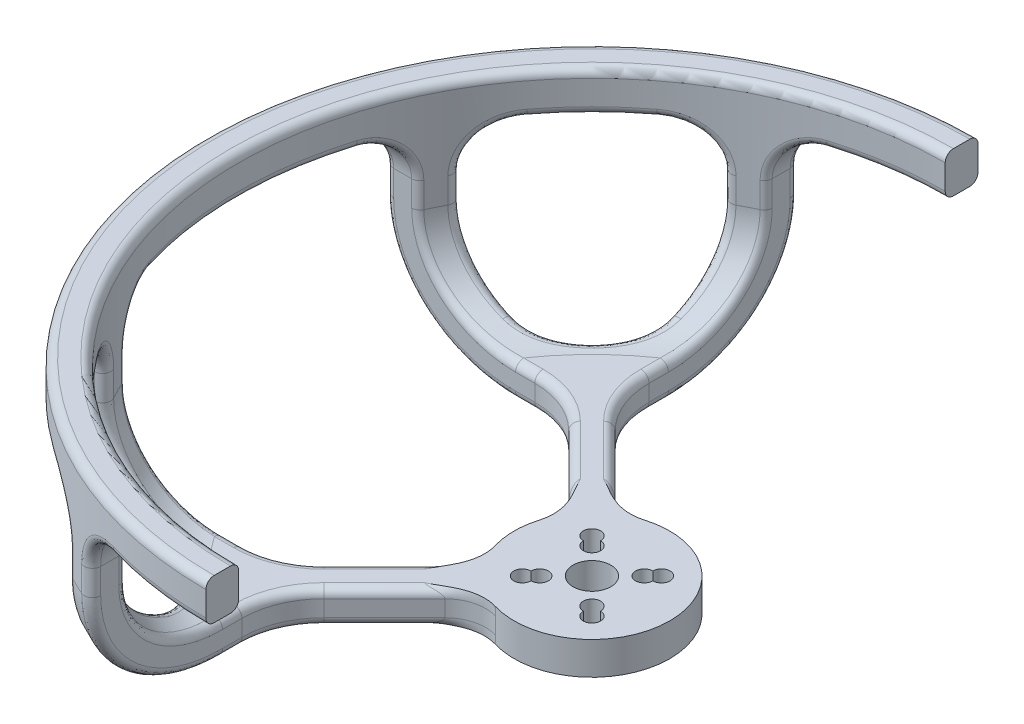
SolidWorks part; units mm, degrees
ref_plane "Front Plane" through (0, 0, 0) normal (0, 0, 1) x (1, 0, 0)
ref_plane "Top Plane" through (0, 0, 0) normal (0, 1, 0) x (1, 0, 0)
ref_plane "Right Plane" through (0, 0, 0) normal (1, 0, 0) x (0, 0, -1)
sketch "Sketch1" plane through (0, 0, 0) normal (0, 1, 0) x (1, 0, 0)
  line L0 (-4.2426, 4.2426) -> (0, 0) construction
  line L1 (0, 0) -> (0, 9.5) construction
  circle A0 centre (0, 0) radius 9.5
  circle A1 centre (-4.2426, 4.2426) radius 1.05
  circle A2 centre (-3.182, 3.182) radius 1.05
  circle A3 centre (3.182, 3.182) radius 1.05
  circle A4 centre (4.2426, 4.2426) radius 1.05
  circle A5 centre (3.182, -3.182) radius 1.05
  circle A6 centre (4.2426, -4.2426) radius 1.05
  circle A7 centre (-3.182, -3.182) radius 1.05
  circle A8 centre (-4.2426, -4.2426) radius 1.05
  circle A9 centre (0, 0) radius 2.3
  point P23 (0, 0)
  dimension "D2" = 2.1
  dimension "D3" = 4.5
  dimension "D4" = 6
  dimension "D5" = 19
  dimension "D7" = 4.6
  dimension "D1" = 45
  dimension "D6" = 4
extrude "Boss-Extrude1" add sketch "Sketch1" along normal blind 4 contours A0 A8 A7 A6 A5 A4 A3 A2 A1
ref_plane "Plane1" through (0, 27.1, 0) normal (0, 1, 0) x (1, 0, 0)
sketch "change diameter here" plane through (0, 27.1, 0) normal (0, 1, 0) x (1, 0, 0)
  line L0 (0, 47.1) -> (0, -47.1) construction
  line L1 (0, 0) -> (0, 9.5) construction
  line L2 (0, 47.1) -> (0, 43.1)
  line L3 (0, -43.1) -> (0, -47.1)
  arc A0 (0, 43.1) -> (0, -43.1) centre (0, 0) ccw
  arc A1 (0, 47.1) -> (0, -47.1) centre (0, 0) ccw
  circle A2 centre (0, 0) radius 9.5 construction
  circle A3 centre (0, 0) radius 43.1 construction
  circle A4 centre (0, 0) radius 47.1 construction
  point P7 (39.3041, 12.0165)
  point P10 (43.1293, 13.186)
  dimension "D1" = 86.2
  dimension "D2" = 4
extrude "outer guard" add sketch "change diameter here" against normal blind 5 separate body
sketch "Sketch3" plane through (0, 0, 0) normal (0, -1, 0) x (1, 0, 0)
  line L0 (0, 0) -> (-30.4763, 30.4763) construction
  line L1 (0, 0) -> (-30.4763, -30.4763) construction
  line L2 (0, -43.1) -> (0, -47.1) construction
  line L3 (0, 47.1) -> (0, 43.1) construction
  line L4 (0, 0) -> (-19.8697, 19.8697) construction
  line L5 (-1.4142, -1.4142) -> (-21.2839, 18.4555)
  line L6 (1.4142, 1.4142) -> (-18.4555, 21.2839)
  line L7 (0, 0) -> (-19.8697, -19.8697) construction
  line L8 (1.4142, -1.4142) -> (-18.4555, -21.2839)
  line L9 (-1.4142, 1.4142) -> (-21.2839, -18.4555)
  arc A0 (0, 43.1) -> (0, -43.1) centre (0, 0) ccw construction
  arc A1 (-1.4142, -1.4142) -> (1.4142, 1.4142) centre (0, 0) ccw
  arc A2 (-18.4555, 21.2839) -> (-21.2839, 18.4555) centre (-19.8697, 19.8697) ccw
  arc A3 (1.4142, -1.4142) -> (-1.4142, 1.4142) centre (0, 0) ccw
  arc A4 (-21.2839, -18.4555) -> (-18.4555, -21.2839) centre (-19.8697, -19.8697) ccw
  circle A5 centre (0, 0) radius 9.5 construction
  circle A6 centre (0, 0) radius 9.5
  point P11 (-9.9349, 9.9349)
  point P17 (-9.9349, -9.9349)
extrude "Boss-Extrude3" add sketch "Sketch3" against normal up to surface (4 mm away) contours L6 A2 L5 M12 | L9 A4 L8 M12
sketch "Sketch6" plane through (0, 4, 0) normal (0, 1, 0) x (1, 0, 0)
  line L0 (-19.8697, -19.8697) -> (-40.4871, -19.8697) construction
  line L1 (-19.8697, -21.8697) -> (-40.4871, -21.8697)
  line L2 (-19.8697, -17.8697) -> (-40.4871, -17.8697)
  line L3 (-19.8697, -19.8697) -> (-19.8697, -40.4871) construction
  line L4 (-17.8697, -19.8697) -> (-17.8697, -40.4871)
  line L5 (-21.8697, -19.8697) -> (-21.8697, -40.4871)
  line L6 (-40.4871, -17.8697) -> (-43.5785, -17.8697)
  line L7 (-40.4871, -21.8697) -> (-41.7148, -21.8697)
  line L8 (-21.8697, -40.4871) -> (-21.8697, -41.7148)
  line L9 (-17.8697, -40.4871) -> (-17.8697, -43.5785)
  line L10 (-19.8697, 19.8697) -> (-19.8697, 40.4871) construction
  line L11 (-21.8697, 19.8697) -> (-21.8697, 40.4871)
  line L12 (-17.8697, 19.8697) -> (-17.8697, 40.4871)
  line L13 (-19.8697, 19.8697) -> (-40.4871, 19.8697) construction
  line L14 (-19.8697, 17.8697) -> (-40.4871, 17.8697)
  line L15 (-19.8697, 21.8697) -> (-40.4871, 21.8697)
  line L16 (-17.8697, 40.4871) -> (-17.8697, 43.5785)
  line L17 (-21.8697, 40.4871) -> (-21.8697, 41.7148)
  line L18 (-40.4871, 17.8697) -> (-43.5785, 17.8697)
  line L19 (-40.4871, 21.8697) -> (-41.7148, 21.8697)
  arc A0 (-21.2839, -18.4555) -> (-18.4555, -21.2839) centre (-19.8697, -19.8697) ccw construction
  arc A1 (-21.2839, -18.4555) -> (-18.4555, -21.2839) centre (-19.8697, -19.8697) ccw
  arc A2 (-19.8697, -21.8697) -> (-19.8697, -17.8697) centre (-19.8697, -19.8697) ccw
  arc A3 (-40.4871, -17.8697) -> (-40.4871, -21.8697) centre (-40.4871, -19.8697) ccw
  arc A4 (-17.8697, -19.8697) -> (-21.8697, -19.8697) centre (-19.8697, -19.8697) ccw
  arc A5 (-21.8697, -40.4871) -> (-17.8697, -40.4871) centre (-19.8697, -40.4871) ccw
  arc A6 (0, 47.1) -> (0, -47.1) centre (0, 0) ccw construction
  arc A7 (0, 47.1) -> (0, -47.1) centre (0, 0) ccw
  arc A8 (-18.4555, 21.2839) -> (-21.2839, 18.4555) centre (-19.8697, 19.8697) ccw construction
  arc A9 (-18.4555, 21.2839) -> (-21.2839, 18.4555) centre (-19.8697, 19.8697) ccw
  arc A10 (-21.8697, 19.8697) -> (-17.8697, 19.8697) centre (-19.8697, 19.8697) ccw
  arc A11 (-17.8697, 40.4871) -> (-21.8697, 40.4871) centre (-19.8697, 40.4871) ccw
  arc A12 (-19.8697, 17.8697) -> (-19.8697, 21.8697) centre (-19.8697, 19.8697) ccw
  arc A13 (-40.4871, 21.8697) -> (-40.4871, 17.8697) centre (-40.4871, 19.8697) ccw
  point P3 (-30.1784, -19.8697)
  point P9 (-19.8697, -30.1784)
  point P30 (-19.8697, 30.1784)
  point P36 (-30.1784, 19.8697)
  dimension "D1" = 90
  dimension "D2" = 90
extrude "Boss-Extrude4" add sketch "Sketch6" against normal up to surface (4 mm away) contours L2 A3 L1 L5 M26 M25 | L5 L1 M26 | L5 A5 L4 L1 M27 M26 | A5 A7 L9 | L8 A7 A5 | L6 A7 A3 | A3 A7 L7 | L12 A11 L11 L15 M22 M21 | L15 A13 L14 L11 M23 M22 | A13 A7 L18 | A13 L19 A7 | A11 L16 A7 | A11 A7 L17 | A10 A12 M22 | L15 L11 M22
sketch "Sketch7" plane through (0, 4, 0) normal (0, 1, 0) x (1, 0, 0)
  line L2 (0, 43.1) -> (0, 47.1)
  line L3 (0, -47.1) -> (0, -43.1)
  line L4 (0, 43.1) -> (0, 47.1)
  line L5 (0, -47.1) -> (0, -43.1)
  line L8 (-5.1527, 7.9812) -> (-17.8697, 20.6981)
  line L9 (-20.6981, 17.8697) -> (-7.9812, 5.1527)
  line L11 (-20.6981, 17.8697) -> (-7.9812, 5.1527)
  line L12 (-41.7148, -21.8697) -> (-21.8697, -21.8697)
  line L15 (-17.8697, -20.6981) -> (-5.1527, -7.9812)
  line L16 (-5.1527, 7.9812) -> (-17.8697, 20.6981)
  line L20 (-41.7148, -21.8697) -> (-21.8697, -21.8697)
  line L23 (-17.8697, -20.6981) -> (-5.1527, -7.9812)
  line L31 (-7.9812, -5.1527) -> (-20.6981, -17.8697)
  line L32 (-7.9812, -5.1527) -> (-20.6981, -17.8697)
  line L34 (-20.6981, -17.8697) -> (-43.5785, -17.8697)
  line L36 (-20.6981, -17.8697) -> (-43.5785, -17.8697)
  line L38 (-21.8697, -21.8697) -> (-21.8697, -41.7148)
  line L40 (-21.8697, -21.8697) -> (-21.8697, -41.7148)
  line L41 (-17.8697, -43.5785) -> (-17.8697, -20.6981)
  line L42 (-17.8697, -43.5785) -> (-17.8697, -20.6981)
  line L43 (-17.8697, 20.6981) -> (-17.8697, 43.5785)
  line L44 (-17.8697, 20.6981) -> (-17.8697, 43.5785)
  line L45 (-21.8697, 41.7148) -> (-21.8697, 21.8697)
  line L46 (-21.8697, 41.7148) -> (-21.8697, 21.8697)
  line L47 (-21.8697, 21.8697) -> (-41.7148, 21.8697)
  line L48 (-21.8697, 21.8697) -> (-41.7148, 21.8697)
  line L49 (-43.5785, 17.8697) -> (-20.6981, 17.8697)
  line L50 (-43.5785, 17.8697) -> (-20.6981, 17.8697)
  arc A2 (0, 43.1) -> (0, -43.1) centre (0, 0) ccw
  arc A3 (0, 47.1) -> (0, -47.1) centre (0, 0) ccw
  arc A4 (0, 43.1) -> (0, -43.1) centre (0, 0) ccw
  arc A5 (-5.1527, -7.9812) -> (-5.1527, 7.9812) centre (0, 0) ccw
  arc A6 (-7.9812, 5.1527) -> (-7.9812, -5.1527) centre (0, 0) ccw
  arc A8 (-43.5785, -17.8697) -> (-41.7148, -21.8697) centre (0, 0) ccw
  arc A10 (-5.1527, -7.9812) -> (-5.1527, 7.9812) centre (0, 0) ccw
  arc A13 (-43.5785, -17.8697) -> (-41.7148, -21.8697) centre (0, 0) ccw
  arc A15 (0, 47.1) -> (0, -47.1) centre (0, 0) ccw
  arc A19 (-7.9812, 5.1527) -> (-7.9812, -5.1527) centre (0, 0) ccw
  arc A21 (-21.8697, -41.7148) -> (-17.8697, -43.5785) centre (0, 0) ccw
  arc A23 (-21.8697, -41.7148) -> (-17.8697, -43.5785) centre (0, 0) ccw
  arc A24 (-17.8697, 43.5785) -> (-21.8697, 41.7148) centre (0, 0) ccw
  arc A25 (-17.8697, 43.5785) -> (-21.8697, 41.7148) centre (0, 0) ccw
  arc A26 (-41.7148, 21.8697) -> (-43.5785, 17.8697) centre (0, 0) ccw
  arc A27 (-41.7148, 21.8697) -> (-43.5785, 17.8697) centre (0, 0) ccw
  dimension "D1" = 0
  dimension "D2" = 0
extrude "Boss-Extrude5" add sketch "Sketch7" along normal up to surface (18.1 mm away) contours A4 L36 M34 M35 | A4 L40 M37 M38 | A4 L44 M58 M59 | A4 L48 M61 M62
fillet "Fillet1" radius 10 4 edges at (-19.8969, 4, 38.2325) (-38.2325, 4, 19.8969) (-19.8969, 4, -38.2325) (-38.2325, 4, -19.8969)
fillet "Fillet2" radius 14 4 edges at (-19.8915, 0, -42.6935) (-42.6935, 0, -19.8915) (-42.6935, 0, 19.8915) (-19.8915, 0, 42.6935)
fillet "Fillet6" radius 5 8 edges at (-17.8697, 22.1, -41.3997) (-21.8697, 22.1, -39.4271) (-41.3997, 22.1, -17.8697) (-39.4271, 22.1, -21.8697) (-21.8697, 22.1, 39.4271) (-17.8697, 22.1, 41.3997) (-41.3997, 22.1, 17.8697) (-39.4271, 22.1, 21.8697)
fillet "Fillet3" radius 10 6 edges at (-17.8697, 2, -20.6981) (-21.8697, 2, -21.8697) (-20.6981, 2, -17.8697) (-20.6981, 2, 17.8697) (-21.8697, 2, 21.8697) (-17.8697, 2, 20.6981)
fillet "Fillet4" radius 1 88 edges at (-6.497, 22.1, -46.6498) (-17.8697, 6.9291, 35.9778) (-21.8697, 11.05, 36.6219) (-37.1749, 8.2009, 17.8697) (-17.8697, 8.2009, -37.1749) (-35.9778, 6.9291, -17.8697) (-36.6219, 11.05, -21.8697) (-17.8697, 0, -26.3511) (-17.8697, 0, 26.3511) (-26.3511, 0, 17.8697) (-26.3511, 0, -17.8697) (-17.8697, 15.55, -43.5785) (-17.8697, 3.9436, -38.9351) (-21.8697, 15.55, -41.7148) (-41.7148, 15.55, -21.8697) (-43.5785, 15.55, -17.8697) (-21.8697, 15.55, 41.7148) (-17.8697, 15.55, 43.5785) (-21.8697, 6.0642, -38.9085) (-40.6852, 5.7852, -17.8697) (-38.9351, 3.9436, 17.8697) (-38.9085, 6.0642, 21.8697) (-17.8697, 5.7852, 40.6852) (-6.5095, 22.1, -42.6056) (-17.8697, 15.55, -39.221) (-33.3047, 22.1, -33.3047) (-30.4763, 22.1, -30.4763) (-21.8697, 15.55, -37.1393) (-43.1, 22.1, 0) (-47.1, 22.1, 0) (-39.221, 15.55, -17.8697) (-37.1393, 15.55, -21.8697) (-33.3047, 22.1, 33.3047) (-30.4763, 22.1, 30.4763) (-21.8697, 15.55, 37.1393) (-6.497, 22.1, 46.6498) (-17.8697, 15.55, 39.221) (-43.5785, 15.55, 17.8697) (-39.221, 15.55, 17.8697) (-41.7148, 15.55, 21.8697) (-37.1393, 15.55, 21.8697) (-16.1049, 20.9122, -44.2611) (-16.9221, 20.0289, -39.639) (-23.44, 20.7383, -36.1687) (-22.7547, 19.9402, -41.2387) (-39.9687, 20.8925, -16.128) (-43.9643, 20.0615, -16.8983) (-40.8907, 20.6753, -23.3744) (-36.0145, 20.9474, -23.6763) (-23.3744, 20.6753, 40.8907) (-23.6763, 20.9474, 36.0145) (-16.128, 20.8925, 39.9687) (-16.8983, 20.0615, 43.9643) (-44.2611, 20.9122, 16.1049) (-39.639, 20.0289, 16.9221) (-36.1687, 20.7383, 23.44) (-41.2387, 19.9402, 22.7547) (-10.0468, 4, -12.8752) (-12.8752, 4, 10.0468) (-12.8752, 4, -10.0468) (-10.0468, 4, 12.8752) (-10.0468, 0, 12.8752) (-12.8752, 0, -10.0468) (-17.8697, 4, -26.3511) (-21.8697, 9.6183, -35.961) (-40.0505, 7.7601, -21.8697) (-26.3511, 4, -17.8697) (-26.3511, 4, 17.8697) (-35.961, 9.6183, 21.8697) (-21.8697, 7.7601, 40.0505) (-10.0468, 0, -12.8752) (-17.8697, 4, 26.3511) (-17.1085, 4, -21.0134) (-12.8752, 0, 10.0468) (-17.1085, 0, -21.0134) (-25.1346, 4.1989, -24.478) (-26.2128, 0.1719, -23.6235) (-21.0134, 4, -17.1085) (-21.0134, 0, -17.1085) (-21.0134, 4, 17.1085) (-21.0134, 0, 17.1085) (-24.478, 4.1989, 25.1346) (-23.6235, 0.1719, 26.2128) (-17.1085, 4, 21.0134) (-17.1085, 0, 21.0134) (-6.5095, 22.1, 42.6056) (-47.1, 27.1, 0) (-43.1, 27.1, 0)
fillet "Fillet5" radius 5 12 edges at (-5.333, 3.6155, -7.8618) (-5.4675, 0.2213, -7.769) (-7.769, 3.7787, -5.4675) (-7.8618, 0.3845, -5.333) (-7.8618, 3.6155, 5.333) (-7.769, 0.2213, 5.4675) (-5.4675, 3.7787, 7.769) (-5.333, 0.3845, 7.8618) (-5.1527, 2, -7.9812) (-7.9812, 2, -5.1527) (-7.9812, 2, 5.1527) (-5.1527, 2, 7.9812)
equation "\"D2@Sketch3\"=\"D1@Sketch3\""
